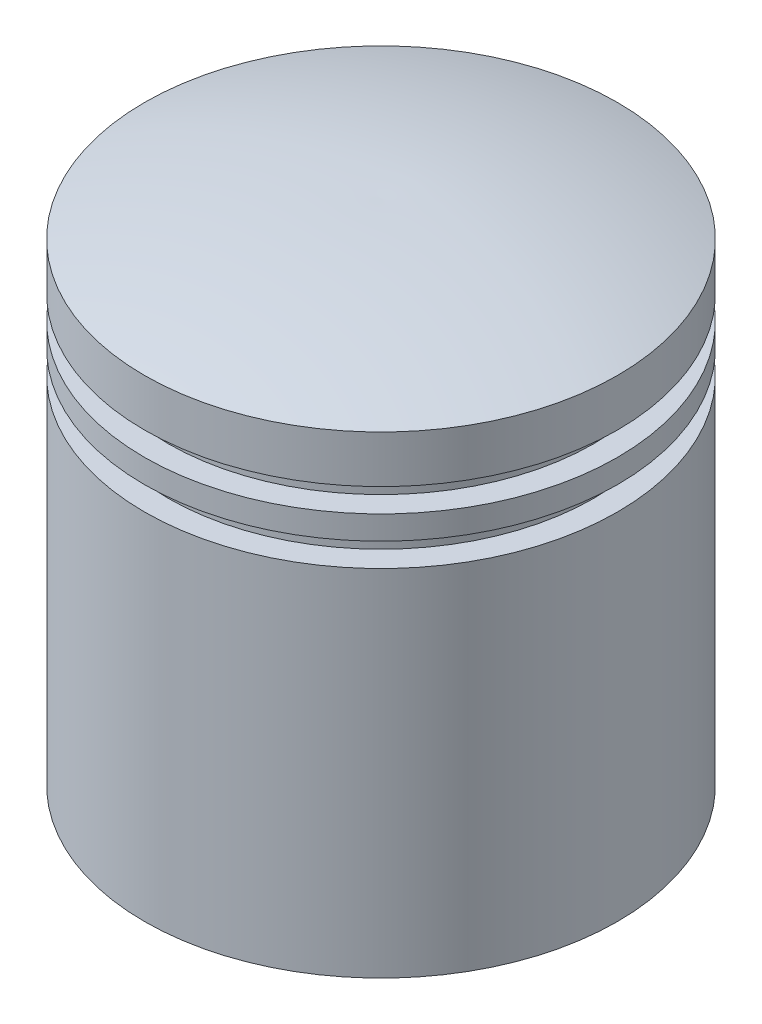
SolidWorks part; units mm, degrees
ref_plane "Front Plane" through (0, 0, 0) normal (0, 0, 1) x (1, 0, 0)
ref_plane "Top Plane" through (0, 0, 0) normal (0, 1, 0) x (1, 0, 0)
ref_plane "Right Plane" through (0, 0, 0) normal (1, 0, 0) x (0, 0, -1)
sketch "Sketch1" plane through (0, 0, 0) normal (0, 0, 1) x (1, 0, 0)
  line L0 (0, 0) -> (0, 63.0762) construction
  line L1 (25.4, 0) -> (25.4, 38.1)
  line L2 (25.4, 38.1) -> (22.86, 38.1)
  line L3 (22.86, 38.1) -> (22.86, 40.64)
  line L4 (22.86, 40.64) -> (25.4, 40.64)
  line L5 (25.4, 40.64) -> (25.4, 43.18)
  line L6 (25.4, 43.18) -> (22.86, 43.18)
  line L7 (22.86, 43.18) -> (22.86, 45.72)
  line L8 (22.86, 45.72) -> (25.4, 45.72)
  line L9 (25.4, 45.72) -> (25.4, 50.8)
  line L10 (25.4, 0) -> (20.955, 0)
  line L11 (20.955, 0) -> (20.955, 19.05)
  line L12 (20.955, 19.05) -> (15.875, 19.05)
  line L13 (15.875, 19.05) -> (15.875, 44.45)
  line L14 (15.875, 44.45) -> (0, 44.45)
  line L15 (0, 54.61) -> (0, 44.45)
  arc A0 (25.4, 50.8) -> (0, 54.61) centre (1.5581, -21.5741) ccw
  dimension "D11" = 76.2
  dimension "D1" = 19.05
  dimension "D2" = 50.8
  dimension "D3" = 31.75
  dimension "D4" = 41.91
  dimension "D5" = 38.1
  dimension "D6" = 25.4
  dimension "D7" = 2.54
  dimension "D8" = 5.08
  dimension "D9" = 2.54
  dimension "D10" = 50.8
  dimension "D12" = 10.16
revolve "Revolve1" add sketch "Sketch1" angle 360 about L0
